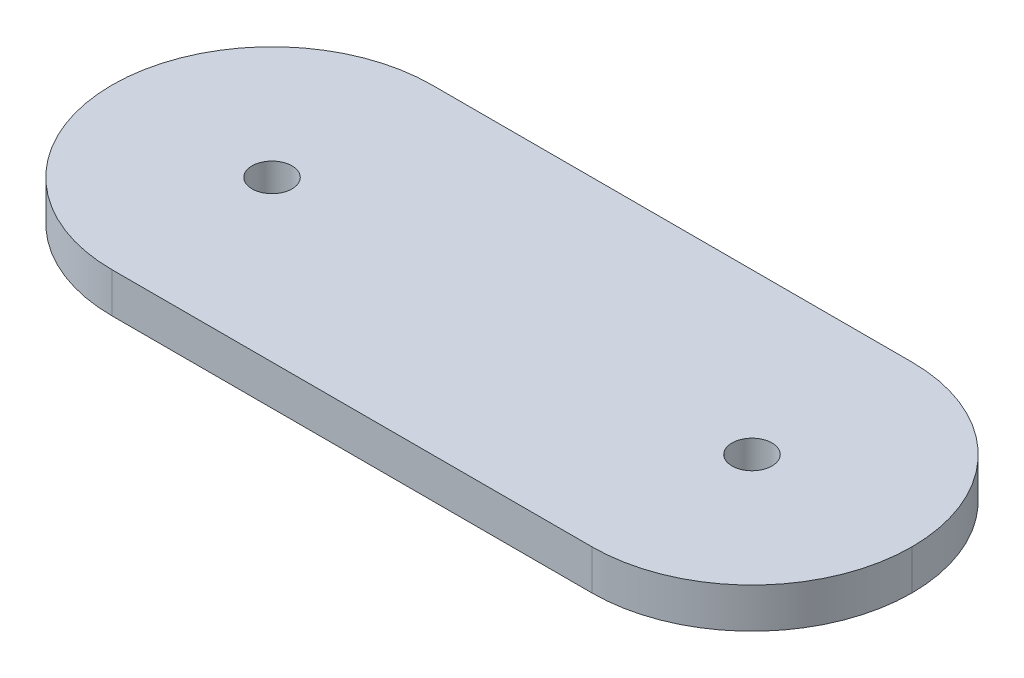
SolidWorks part; units mm, degrees
ref_plane "Front Plane" through (0, 0, 0) normal (0, 0, 1) x (1, 0, 0)
ref_plane "Top Plane" through (0, 0, 0) normal (0, 1, 0) x (1, 0, 0)
ref_plane "Right Plane" through (0, 0, 0) normal (1, 0, 0) x (0, 0, -1)
sketch "Sketch1" plane through (0, 0, 0) normal (0, 1, 0) x (1, 0, 0)
  line L1 (0, 0) -> (254, 0)
  line L2 (0, 0) -> (0, 25.4)
  line L3 (0, 25.4) -> (254, 25.4)
  line L4 (254, 0) -> (254, 25.4)
  dimension "D1" = 254
  dimension "D2" = 25.4
extrude "Boss-Extrude1" add sketch "Sketch1" along normal blind 3.175
sketch "Sketch2" plane through (0, 3.175, 0) normal (0, 1, 0) x (1, 0, 0)
  line L0 (254, 25.4) -> (0, 25.4) construction
  line L1 (0, 25.4) -> (0, 0) construction
  circle A0 centre (12.7, 12.7) radius 1.5875
  circle A1 centre (50.8, 12.7) radius 1.5875
  dimension "D1" = 3.175
  dimension "D2" = 3.175
  dimension "D3" = 12.7
  dimension "D4" = 12.7
  dimension "D5" = 38.1
  dimension "D6" = 38.1
extrude "Cut-Extrude1" cut sketch "Sketch2" against normal blind 3.175
sketch "Sketch3" plane through (0, 3.175, 0) normal (0, 1, 0) x (1, 0, 0)
  line L0 (254, 25.4) -> (0, 25.4) construction
  line L1 (63.5, 25.4) -> (317.5, 25.4)
  line L2 (63.5, 25.4) -> (63.5, 0)
  line L3 (63.5, 0) -> (317.5, 0)
  line L4 (317.5, 25.4) -> (317.5, 0)
  line L5 (0, 0) -> (254, 0) construction
  circle A0 centre (50.8, 12.7) radius 1.5875 construction
  dimension "D1" = 12.7
  dimension "D2" = 254
extrude "Cut-Extrude2" cut sketch "Sketch3" against normal blind 3.175
fillet "Fillet1" radius 12.7 4 edges at (0, 1.5875, 0) (0, 1.5875, -25.4) (63.5, 1.5875, 0) (63.5, 1.5875, -25.4)
